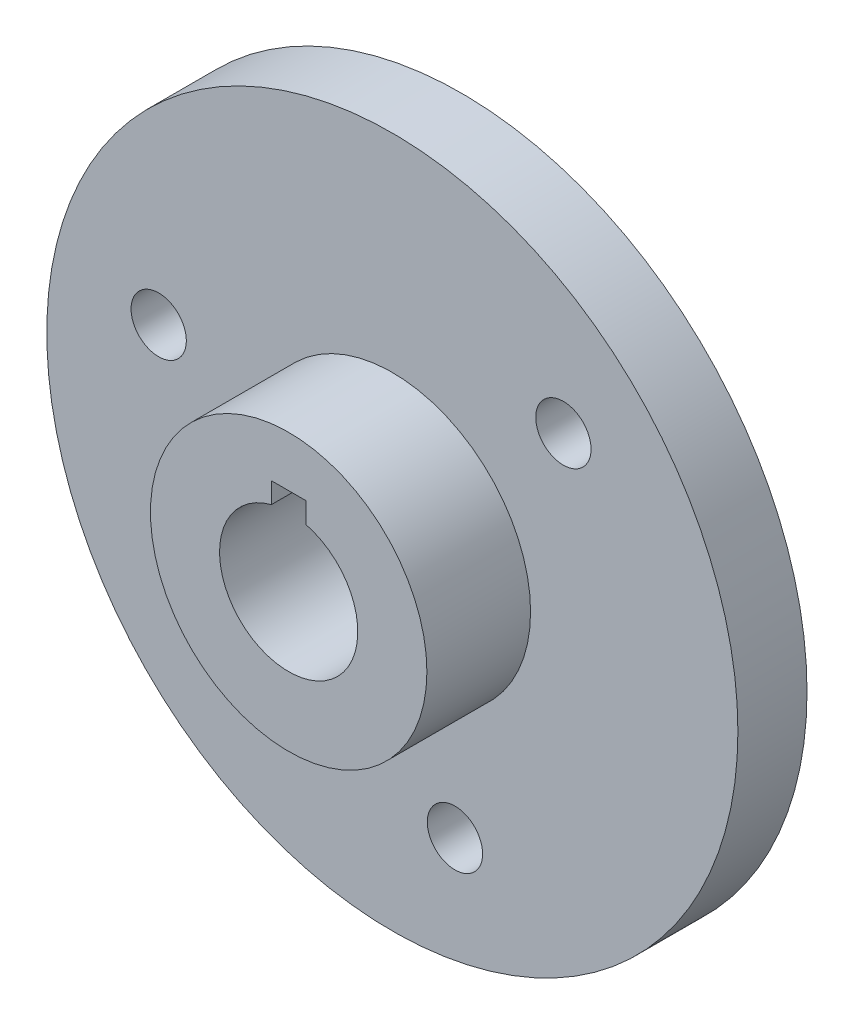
SolidWorks part; units mm, degrees
ref_plane "Front" through (0, 0, 0) normal (0, 0, 1) x (1, 0, 0)
ref_plane "Top" through (0, 0, 0) normal (0, 1, 0) x (1, 0, 0)
ref_plane "Right" through (0, 0, 0) normal (1, 0, 0) x (0, 0, -1)
sketch "Sketch1" plane through (0, 0, 0) normal (1, 0, 0) x (0, 0, -1)
  line L0 (0, 0) -> (71.6266, 0) construction
  line L1 (0, 0) -> (0, 20)
  line L2 (0, 20) -> (15, 20)
  line L3 (15, 20) -> (15, 50)
  line L4 (15, 50) -> (25, 50)
  line L5 (25, 50) -> (25, 0)
  line L6 (25, 0) -> (0, 0)
  dimension "D1" = 40
  dimension "D2" = 100
  dimension "D3" = 10
  dimension "D4" = 15
revolve "Revolve1" add sketch "Sketch1" angle 360 about L0
sketch "Sketch2" plane through (0, 0, 0) normal (0, 0, 1) x (1, 0, 0)
  circle A0 centre (0, 0) radius 10
  dimension "D1" = 20
extrude "Cut-Extrude1" cut sketch "Sketch2" against normal through all
sketch "Sketch3" plane through (0, 0, -15) normal (0, 0, 1) x (1, 0, 0)
  line L0 (0, 0) -> (24.7487, 24.7487) construction
  line L1 (0, 0) -> (50, 0) construction
  circle A0 centre (24.7487, 24.7487) radius 4
  circle A1 centre (0, 0) radius 50 construction
  dimension "D3" = 8
  dimension "D1" = 45
  dimension "D2" = 35
extrude "Cut-Extrude2" cut sketch "Sketch3" against normal through all
pattern_circular "CirPattern1" count 3 over 360 about axis through (0, 0, 0) along (0, 0, 1) of "Cut-Extrude2"
sketch "Sketch4" plane through (0, 0, 0) normal (0, 0, 1) x (1, 0, 0)
  line L0 (0, 0) -> (0, 20) construction
  line L1 (2.5, 9.6825) -> (2.5, 12.6825)
  line L2 (2.5, 12.6825) -> (-2.5, 12.6825)
  line L3 (-2.5, 9.6825) -> (-2.5, 12.6825)
  circle A0 centre (0, 0) radius 20 construction
  circle A1 centre (0, 0) radius 10 construction
  arc A2 (2.5, 9.6825) -> (-2.5, 9.6825) centre (0, 0) ccw
  point P11 (0, 12.6825)
  dimension "D1" = 5
  dimension "D2" = 3
extrude "Cut-Extrude3" cut sketch "Sketch4" against normal through all
